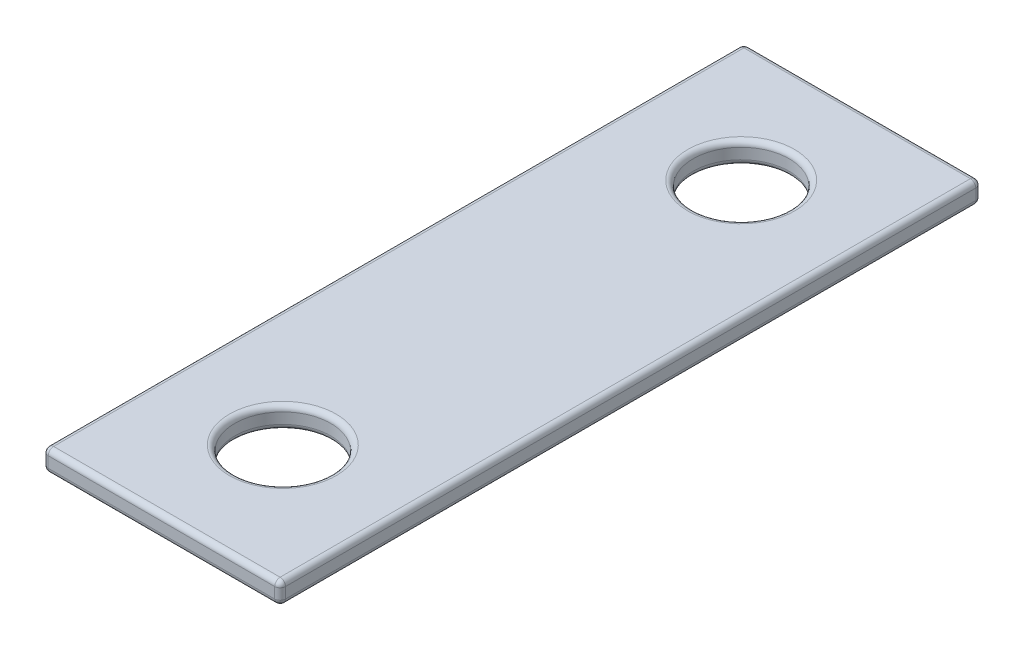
SolidWorks part; units mm, degrees
ref_plane "Front Plane" through (0, 0, 0) normal (0, 0, 1) x (1, 0, 0)
ref_plane "Top Plane" through (0, 0, 0) normal (0, 1, 0) x (1, 0, 0)
ref_plane "Right Plane" through (0, 0, 0) normal (1, 0, 0) x (0, 0, -1)
sketch "Sketch1" plane through (0, 0, 0) normal (0, 1, 0) x (1, 0, 0)
  line L0 (-1.1358, -8.8539) -> (-1.1358, 7.6561)
  line L1 (-6.7238, 7.6561) -> (-1.1358, 7.6561)
  line L2 (-6.7238, 7.6561) -> (-6.7238, -8.8539)
  line L3 (-6.7238, -8.8539) -> (-1.1358, -8.8539)
  circle A0 centre (-3.9298, 4.7986) radius 1.1303
  circle A1 centre (-3.9298, -5.9964) radius 1.1303
  dimension "D8" = 2.2606
  dimension "D10" = 2.2606
  dimension "D11" = 2.794
  dimension "D2" = 2.794
  dimension "D4" = 10.795
  dimension "D6" = 2.794
extrude "Boss-Extrude1" add sketch "Sketch1" along normal blind 0.508
fillet "Fillet1" radius 0.127 16 edges at (-1.1358, 0.254, -7.6561) (-6.7238, 0.254, -7.6561) (-3.9298, 0.508, -7.6561) (-3.9298, 0, -7.6561) (-6.7238, 0, 0.5989) (-1.1358, 0, 0.5989) (-1.1358, 0.508, 0.5989) (-6.7238, 0.508, 0.5989) (-3.9298, 0.508, 8.8539) (-3.9298, 0, 8.8539) (-6.7238, 0.254, 8.8539) (-1.1358, 0.254, 8.8539) (-3.9298, 0, -3.6683) (-3.9298, 0.508, -3.6683) (-3.9298, 0, 7.1267) (-3.9298, 0.508, 7.1267)
